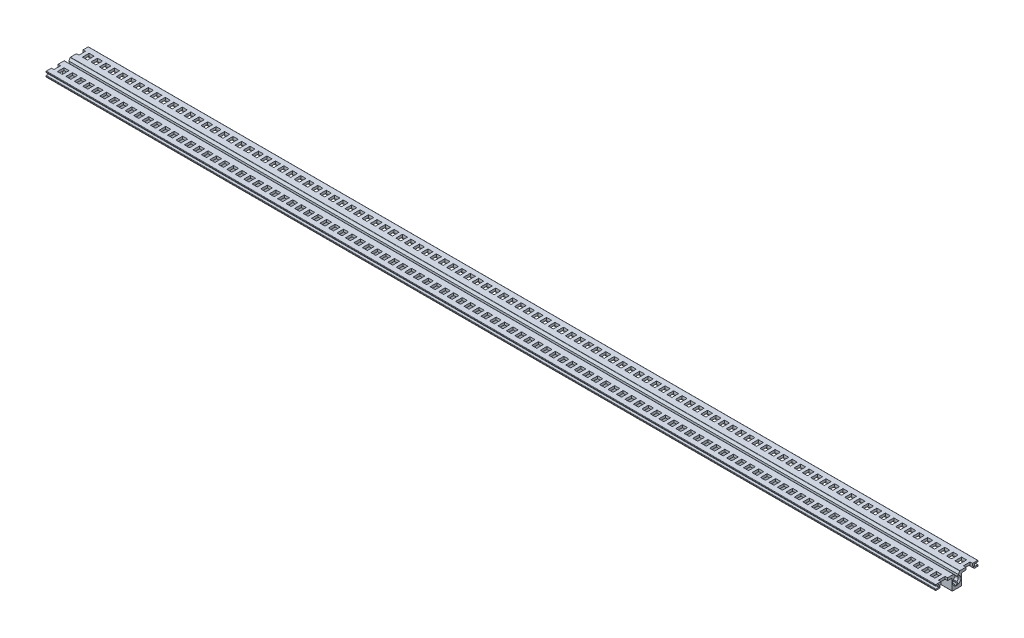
SolidWorks part; units mm, degrees
other "34561584"
ref_plane "前视基准面" through (0, 0, 0) normal (0, 0, 1) x (1, 0, 0)
ref_plane "上视基准面" through (0, 0, 0) normal (0, 1, 0) x (1, 0, 0)
ref_plane "右视基准面" through (0, 0, 0) normal (1, 0, 0) x (0, 0, -1)
imported_body "输入1"
sketch "草图1" plane through (215.9, 0, 0) normal (1, 0, 0) x (0, 0, -1)
  line L1 (-22.0218, 2.0349) -> (8.0675, 2.0349)
  line L2 (-22.0218, 2.0349) -> (-22.0218, -10.461)
  line L3 (-22.0218, -10.461) -> (8.0675, -10.461)
  line L4 (8.0675, 2.0349) -> (8.0675, -10.461)
extrude "切除-拉伸1" cut sketch "草图1" against normal up to vertex
sketch "草图2" plane through (199.16, 0, 0) normal (1, 0, 0) x (0, 0, -1)
  line L28 (-9.4065, 0) -> (-20.05, 0)
  line L29 (-20.25, -0.2) -> (-20.25, -0.6)
  line L30 (-20.05, -0.8) -> (-18.25, -0.8)
  line L31 (-18.25, -0.8) -> (-18.25, -2.3)
  line L32 (-18.25, -2.3) -> (-20.05, -2.3)
  line L33 (-20.25, -2.5) -> (-20.25, -2.9)
  line L34 (-20.05, -3.1) -> (-18.25, -3.1)
  line L35 (-17.45, -2.3) -> (-17.45, -1.5)
  line L36 (-17.45, -1.5) -> (-11.05, -1.5)
  line L37 (-10.25, -2.3) -> (-10.25, -8.2)
  line L38 (-10.05, -8.4) -> (-4.95, -8.4)
  line L39 (-4.75, -8.2) -> (-4.75, -2.3)
  line L40 (-3.95, -1.5) -> (2.45, -1.5)
  line L41 (2.45, -1.5) -> (2.45, -2.3)
  line L42 (3.25, -3.1) -> (5.05, -3.1)
  line L43 (5.25, -2.9) -> (5.25, -2.5)
  line L44 (5.05, -2.3) -> (3.25, -2.3)
  line L45 (3.25, -2.3) -> (3.25, -0.8)
  line L46 (3.25, -0.8) -> (5.05, -0.8)
  line L47 (5.25, -0.6) -> (5.25, -0.2)
  line L48 (5.05, 0) -> (-5.5935, 0)
  line L49 (-5.7667, -0.1) -> (-6.575, -1.5)
  line L50 (-6.575, -1.5) -> (-6.575, -3.3592)
  line L51 (-6.575, -5.0408) -> (-6.575, -6.2)
  line L52 (-6.775, -6.4) -> (-8.225, -6.4)
  line L53 (-8.425, -6.2) -> (-8.425, -5.0408)
  line L54 (-8.425, -3.3592) -> (-8.425, -1.5)
  line L55 (-8.425, -1.5) -> (-9.2333, -0.1)
  line L56 (-9.4065, 0) -> (-20.05, 0)
  line L57 (-20.25, -0.2) -> (-20.25, -0.6)
  line L58 (-20.05, -0.8) -> (-18.25, -0.8)
  line L59 (-18.25, -0.8) -> (-18.25, -2.3)
  line L60 (-18.25, -2.3) -> (-20.05, -2.3)
  line L61 (-20.25, -2.5) -> (-20.25, -2.9)
  line L62 (-20.05, -3.1) -> (-18.25, -3.1)
  line L63 (-17.45, -2.3) -> (-17.45, -1.5)
  line L64 (-17.45, -1.5) -> (-11.05, -1.5)
  line L65 (-10.25, -2.3) -> (-10.25, -8.2)
  line L66 (-10.05, -8.4) -> (-4.95, -8.4)
  line L67 (-4.75, -8.2) -> (-4.75, -2.3)
  line L68 (-3.95, -1.5) -> (2.45, -1.5)
  line L69 (2.45, -1.5) -> (2.45, -2.3)
  line L70 (3.25, -3.1) -> (5.05, -3.1)
  line L71 (5.25, -2.9) -> (5.25, -2.5)
  line L72 (5.05, -2.3) -> (3.25, -2.3)
  line L73 (3.25, -2.3) -> (3.25, -0.8)
  line L74 (3.25, -0.8) -> (5.05, -0.8)
  line L75 (5.25, -0.6) -> (5.25, -0.2)
  line L76 (5.05, 0) -> (-5.5935, 0)
  line L77 (-5.7667, -0.1) -> (-6.575, -1.5)
  line L78 (-6.575, -1.5) -> (-6.575, -3.3592)
  line L79 (-6.575, -5.0408) -> (-6.575, -6.2)
  line L80 (-6.775, -6.4) -> (-8.225, -6.4)
  line L81 (-8.425, -6.2) -> (-8.425, -5.0408)
  line L82 (-8.425, -3.3592) -> (-8.425, -1.5)
  line L83 (-8.425, -1.5) -> (-9.2333, -0.1)
  arc A20 (-20.05, 0) -> (-20.25, -0.2) centre (-20.05, -0.2) ccw
  arc A21 (-20.25, -0.6) -> (-20.05, -0.8) centre (-20.05, -0.6) ccw
  arc A22 (-20.05, -2.3) -> (-20.25, -2.5) centre (-20.05, -2.5) ccw
  arc A23 (-20.25, -2.9) -> (-20.05, -3.1) centre (-20.05, -2.9) ccw
  arc A24 (-18.25, -3.1) -> (-17.45, -2.3) centre (-18.25, -2.3) ccw
  arc A25 (-10.25, -2.3) -> (-11.05, -1.5) centre (-11.05, -2.3) ccw
  arc A26 (-10.25, -8.2) -> (-10.05, -8.4) centre (-10.05, -8.2) ccw
  arc A27 (-4.95, -8.4) -> (-4.75, -8.2) centre (-4.95, -8.2) ccw
  arc A28 (-3.95, -1.5) -> (-4.75, -2.3) centre (-3.95, -2.3) ccw
  arc A29 (2.45, -2.3) -> (3.25, -3.1) centre (3.25, -2.3) ccw
  arc A30 (5.05, -3.1) -> (5.25, -2.9) centre (5.05, -2.9) ccw
  arc A31 (5.25, -2.5) -> (5.05, -2.3) centre (5.05, -2.5) ccw
  arc A32 (5.05, -0.8) -> (5.25, -0.6) centre (5.05, -0.6) ccw
  arc A33 (5.25, -0.2) -> (5.05, 0) centre (5.05, -0.2) ccw
  arc A34 (-5.5935, 0) -> (-5.7667, -0.1) centre (-5.5935, -0.2) ccw
  arc A35 (-6.575, -5.0408) -> (-6.575, -3.3592) centre (-7.5, -4.2) ccw
  arc A36 (-6.775, -6.4) -> (-6.575, -6.2) centre (-6.775, -6.2) ccw
  arc A37 (-8.425, -6.2) -> (-8.225, -6.4) centre (-8.225, -6.2) ccw
  arc A38 (-8.425, -3.3592) -> (-8.425, -5.0408) centre (-7.5, -4.2) ccw
  arc A39 (-9.2333, -0.1) -> (-9.4065, 0) centre (-9.4065, -0.2) ccw
  arc A40 (-20.05, 0) -> (-20.25, -0.2) centre (-20.05, -0.2) ccw
  arc A41 (-20.25, -0.6) -> (-20.05, -0.8) centre (-20.05, -0.6) ccw
  arc A42 (-20.05, -2.3) -> (-20.25, -2.5) centre (-20.05, -2.5) ccw
  arc A43 (-20.25, -2.9) -> (-20.05, -3.1) centre (-20.05, -2.9) ccw
  arc A44 (-18.25, -3.1) -> (-17.45, -2.3) centre (-18.25, -2.3) ccw
  arc A45 (-10.25, -2.3) -> (-11.05, -1.5) centre (-11.05, -2.3) ccw
  arc A46 (-10.25, -8.2) -> (-10.05, -8.4) centre (-10.05, -8.2) ccw
  arc A47 (-4.95, -8.4) -> (-4.75, -8.2) centre (-4.95, -8.2) ccw
  arc A48 (-3.95, -1.5) -> (-4.75, -2.3) centre (-3.95, -2.3) ccw
  arc A49 (2.45, -2.3) -> (3.25, -3.1) centre (3.25, -2.3) ccw
  arc A50 (5.05, -3.1) -> (5.25, -2.9) centre (5.05, -2.9) ccw
  arc A51 (5.25, -2.5) -> (5.05, -2.3) centre (5.05, -2.5) ccw
  arc A52 (5.05, -0.8) -> (5.25, -0.6) centre (5.05, -0.6) ccw
  arc A53 (5.25, -0.2) -> (5.05, 0) centre (5.05, -0.2) ccw
  arc A54 (-5.5935, 0) -> (-5.7667, -0.1) centre (-5.5935, -0.2) ccw
  arc A55 (-6.575, -5.0408) -> (-6.575, -3.3592) centre (-7.5, -4.2) ccw
  arc A56 (-6.775, -6.4) -> (-6.575, -6.2) centre (-6.775, -6.2) ccw
  arc A57 (-8.425, -6.2) -> (-8.225, -6.4) centre (-8.225, -6.2) ccw
  arc A58 (-8.425, -3.3592) -> (-8.425, -5.0408) centre (-7.5, -4.2) ccw
  arc A59 (-9.2333, -0.1) -> (-9.4065, 0) centre (-9.4065, -0.2) ccw
  dimension "D1" = 0
extrude "凸台-拉伸1" add sketch "草图2" along normal blind 118.34
sketch "草图3" plane through (317.5, 0, 0) normal (1, 0, 0) x (0, 0, -1)
  circle A0 centre (-7.5, -4.2) radius 1.65
extrude "切除-拉伸2" cut sketch "草图3" against normal blind 15.02
chamfer "倒角1" distance 0.85 angle 45 1 edges at (317.5, -4.2, 9.15)
sketch "草图4" plane through (0, 0, 0) normal (0, 1, 0) x (1, 0, 0)
  line L0 (197.08, -2) -> (197.08, 2) construction
  line L1 (199.16, 2) -> (202.16, 2)
  line L2 (199.16, 2) -> (199.16, -2)
  line L3 (199.16, -2) -> (202.16, -2)
  line L4 (202.16, 2) -> (202.16, -2)
  line L5 (197.08, -17) -> (197.08, -13) construction
  line L6 (199.16, -13) -> (202.16, -13)
  line L7 (199.16, -13) -> (199.16, -17)
  line L8 (199.16, -17) -> (202.16, -17)
  line L9 (202.16, -13) -> (202.16, -17)
  line L10 (194.08, -17) -> (197.08, -17) construction
  line L11 (204.24, -2) -> (207.24, -2)
  line L12 (207.24, 2) -> (207.24, -2)
  line L13 (204.24, 2) -> (207.24, 2)
  line L14 (204.24, 2) -> (204.24, -2)
  line L15 (204.24, -13) -> (207.24, -13)
  line L16 (207.24, -13) -> (207.24, -17)
  line L17 (204.24, -17) -> (207.24, -17)
  line L18 (204.24, -13) -> (204.24, -17)
  line L19 (209.32, -2) -> (212.32, -2)
  line L20 (212.32, 2) -> (212.32, -2)
  line L21 (209.32, 2) -> (212.32, 2)
  line L22 (209.32, 2) -> (209.32, -2)
  line L23 (209.32, -13) -> (212.32, -13)
  line L24 (212.32, -13) -> (212.32, -17)
  line L25 (209.32, -17) -> (212.32, -17)
  line L26 (209.32, -13) -> (209.32, -17)
  line L27 (214.4, -2) -> (217.4, -2)
  line L28 (217.4, 2) -> (217.4, -2)
  line L29 (214.4, 2) -> (217.4, 2)
  line L30 (214.4, 2) -> (214.4, -2)
  line L31 (214.4, -13) -> (217.4, -13)
  line L32 (217.4, -13) -> (217.4, -17)
  line L33 (214.4, -17) -> (217.4, -17)
  line L34 (214.4, -13) -> (214.4, -17)
  line L35 (219.48, -2) -> (222.48, -2)
  line L36 (222.48, 2) -> (222.48, -2)
  line L37 (219.48, 2) -> (222.48, 2)
  line L38 (219.48, 2) -> (219.48, -2)
  line L39 (219.48, -13) -> (222.48, -13)
  line L40 (222.48, -13) -> (222.48, -17)
  line L41 (219.48, -17) -> (222.48, -17)
  line L42 (219.48, -13) -> (219.48, -17)
  line L43 (224.56, -2) -> (227.56, -2)
  line L44 (227.56, 2) -> (227.56, -2)
  line L45 (224.56, 2) -> (227.56, 2)
  line L46 (224.56, 2) -> (224.56, -2)
  line L47 (224.56, -13) -> (227.56, -13)
  line L48 (227.56, -13) -> (227.56, -17)
  line L49 (224.56, -17) -> (227.56, -17)
  line L50 (224.56, -13) -> (224.56, -17)
  line L51 (229.64, -2) -> (232.64, -2)
  line L52 (232.64, 2) -> (232.64, -2)
  line L53 (229.64, 2) -> (232.64, 2)
  line L54 (229.64, 2) -> (229.64, -2)
  line L55 (229.64, -13) -> (232.64, -13)
  line L56 (232.64, -13) -> (232.64, -17)
  line L57 (229.64, -17) -> (232.64, -17)
  line L58 (229.64, -13) -> (229.64, -17)
  line L59 (234.72, -2) -> (237.72, -2)
  line L60 (237.72, 2) -> (237.72, -2)
  line L61 (234.72, 2) -> (237.72, 2)
  line L62 (234.72, 2) -> (234.72, -2)
  line L63 (234.72, -13) -> (237.72, -13)
  line L64 (237.72, -13) -> (237.72, -17)
  line L65 (234.72, -17) -> (237.72, -17)
  line L66 (234.72, -13) -> (234.72, -17)
  line L67 (239.8, -2) -> (242.8, -2)
  line L68 (242.8, 2) -> (242.8, -2)
  line L69 (239.8, 2) -> (242.8, 2)
  line L70 (239.8, 2) -> (239.8, -2)
  line L71 (239.8, -13) -> (242.8, -13)
  line L72 (242.8, -13) -> (242.8, -17)
  line L73 (239.8, -17) -> (242.8, -17)
  line L74 (239.8, -13) -> (239.8, -17)
  line L75 (244.88, -2) -> (247.88, -2)
  line L76 (247.88, 2) -> (247.88, -2)
  line L77 (244.88, 2) -> (247.88, 2)
  line L78 (244.88, 2) -> (244.88, -2)
  line L79 (244.88, -13) -> (247.88, -13)
  line L80 (247.88, -13) -> (247.88, -17)
  line L81 (244.88, -17) -> (247.88, -17)
  line L82 (244.88, -13) -> (244.88, -17)
  line L83 (249.96, -2) -> (252.96, -2)
  line L84 (252.96, 2) -> (252.96, -2)
  line L85 (249.96, 2) -> (252.96, 2)
  line L86 (249.96, 2) -> (249.96, -2)
  line L87 (249.96, -13) -> (252.96, -13)
  line L88 (252.96, -13) -> (252.96, -17)
  line L89 (249.96, -17) -> (252.96, -17)
  line L90 (249.96, -13) -> (249.96, -17)
  line L91 (255.04, -2) -> (258.04, -2)
  line L92 (258.04, 2) -> (258.04, -2)
  line L93 (255.04, 2) -> (258.04, 2)
  line L94 (255.04, 2) -> (255.04, -2)
  line L95 (255.04, -13) -> (258.04, -13)
  line L96 (258.04, -13) -> (258.04, -17)
  line L97 (255.04, -17) -> (258.04, -17)
  line L98 (255.04, -13) -> (255.04, -17)
  line L99 (260.12, -2) -> (263.12, -2)
  line L100 (263.12, 2) -> (263.12, -2)
  line L101 (260.12, 2) -> (263.12, 2)
  line L102 (260.12, 2) -> (260.12, -2)
  line L103 (260.12, -13) -> (263.12, -13)
  line L104 (263.12, -13) -> (263.12, -17)
  line L105 (260.12, -17) -> (263.12, -17)
  line L106 (260.12, -13) -> (260.12, -17)
  line L107 (265.2, -2) -> (268.2, -2)
  line L108 (268.2, 2) -> (268.2, -2)
  line L109 (265.2, 2) -> (268.2, 2)
  line L110 (265.2, 2) -> (265.2, -2)
  line L111 (265.2, -13) -> (268.2, -13)
  line L112 (268.2, -13) -> (268.2, -17)
  line L113 (265.2, -17) -> (268.2, -17)
  line L114 (265.2, -13) -> (265.2, -17)
  line L115 (270.28, -2) -> (273.28, -2)
  line L116 (273.28, 2) -> (273.28, -2)
  line L117 (270.28, 2) -> (273.28, 2)
  line L118 (270.28, 2) -> (270.28, -2)
  line L119 (270.28, -13) -> (273.28, -13)
  line L120 (273.28, -13) -> (273.28, -17)
  line L121 (270.28, -17) -> (273.28, -17)
  line L122 (270.28, -13) -> (270.28, -17)
  line L123 (275.36, -2) -> (278.36, -2)
  line L124 (278.36, 2) -> (278.36, -2)
  line L125 (275.36, 2) -> (278.36, 2)
  line L126 (275.36, 2) -> (275.36, -2)
  line L127 (275.36, -13) -> (278.36, -13)
  line L128 (278.36, -13) -> (278.36, -17)
  line L129 (275.36, -17) -> (278.36, -17)
  line L130 (275.36, -13) -> (275.36, -17)
  line L131 (280.44, -2) -> (283.44, -2)
  line L132 (283.44, 2) -> (283.44, -2)
  line L133 (280.44, 2) -> (283.44, 2)
  line L134 (280.44, 2) -> (280.44, -2)
  line L135 (280.44, -13) -> (283.44, -13)
  line L136 (283.44, -13) -> (283.44, -17)
  line L137 (280.44, -17) -> (283.44, -17)
  line L138 (280.44, -13) -> (280.44, -17)
  line L139 (285.52, -2) -> (288.52, -2)
  line L140 (288.52, 2) -> (288.52, -2)
  line L141 (285.52, 2) -> (288.52, 2)
  line L142 (285.52, 2) -> (285.52, -2)
  line L143 (285.52, -13) -> (288.52, -13)
  line L144 (288.52, -13) -> (288.52, -17)
  line L145 (285.52, -17) -> (288.52, -17)
  line L146 (285.52, -13) -> (285.52, -17)
  line L147 (290.6, -2) -> (293.6, -2)
  line L148 (293.6, 2) -> (293.6, -2)
  line L149 (290.6, 2) -> (293.6, 2)
  line L150 (290.6, 2) -> (290.6, -2)
  line L151 (290.6, -13) -> (293.6, -13)
  line L152 (293.6, -13) -> (293.6, -17)
  line L153 (290.6, -17) -> (293.6, -17)
  line L154 (290.6, -13) -> (290.6, -17)
  line L155 (295.68, -2) -> (298.68, -2)
  line L156 (298.68, 2) -> (298.68, -2)
  line L157 (295.68, 2) -> (298.68, 2)
  line L158 (295.68, 2) -> (295.68, -2)
  line L159 (295.68, -13) -> (298.68, -13)
  line L160 (298.68, -13) -> (298.68, -17)
  line L161 (295.68, -17) -> (298.68, -17)
  line L162 (295.68, -13) -> (295.68, -17)
  line L163 (300.76, -2) -> (303.76, -2)
  line L164 (303.76, 2) -> (303.76, -2)
  line L165 (300.76, 2) -> (303.76, 2)
  line L166 (300.76, 2) -> (300.76, -2)
  line L167 (300.76, -13) -> (303.76, -13)
  line L168 (303.76, -13) -> (303.76, -17)
  line L169 (300.76, -17) -> (303.76, -17)
  line L170 (300.76, -13) -> (300.76, -17)
  line L171 (305.84, -2) -> (308.84, -2)
  line L172 (308.84, 2) -> (308.84, -2)
  line L173 (305.84, 2) -> (308.84, 2)
  line L174 (305.84, 2) -> (305.84, -2)
  line L175 (305.84, -13) -> (308.84, -13)
  line L176 (308.84, -13) -> (308.84, -17)
  line L177 (305.84, -17) -> (308.84, -17)
  line L178 (305.84, -13) -> (305.84, -17)
  line L179 (310.92, -2) -> (313.92, -2)
  line L180 (313.92, 2) -> (313.92, -2)
  line L181 (310.92, 2) -> (313.92, 2)
  line L182 (310.92, 2) -> (310.92, -2)
  line L183 (310.92, -13) -> (313.92, -13)
  line L184 (313.92, -13) -> (313.92, -17)
  line L185 (310.92, -17) -> (313.92, -17)
  line L186 (310.92, -13) -> (310.92, -17)
  line L187 (316, -2) -> (319, -2)
  line L188 (319, 2) -> (319, -2)
  line L189 (316, 2) -> (319, 2)
  line L190 (316, 2) -> (316, -2)
  line L191 (316, -13) -> (319, -13)
  line L192 (319, -13) -> (319, -17)
  line L193 (316, -17) -> (319, -17)
  line L194 (316, -13) -> (316, -17)
  dimension "D1" = 3
  dimension "D2" = 5.08
  dimension "D3" = 3
  dimension "D4" = 5.08
  dimension "D5" = 24
extrude "切除-拉伸3" cut sketch "草图4" against normal through all
